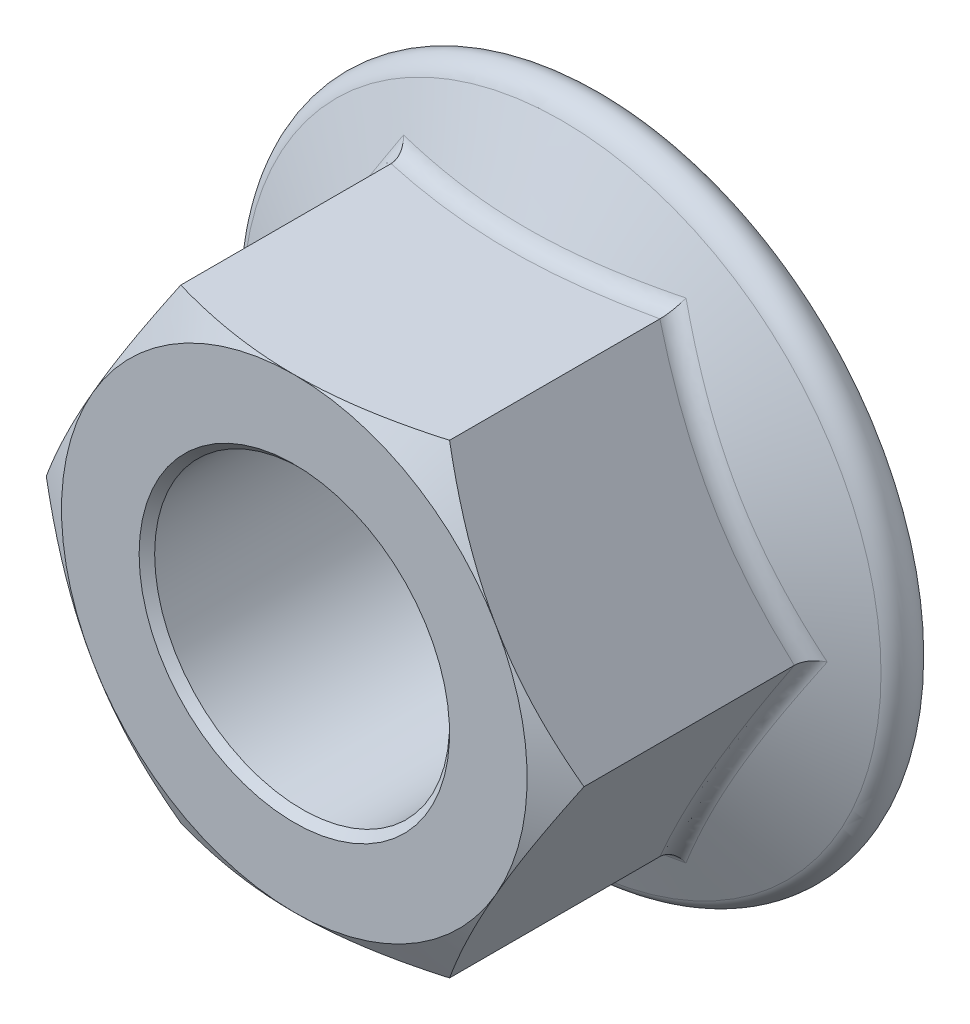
SolidWorks part; units mm, degrees
ref_plane "Front" through (0, 0, 0) normal (0, 0, 1) x (1, 0, 0)
ref_plane "Top" through (0, 0, 0) normal (0, 1, 0) x (1, 0, 0)
ref_plane "Right" through (0, 0, 0) normal (1, 0, 0) x (0, 0, -1)
other "Configuration Table"
sketch "Sketch1" plane through (0, 0, 0) normal (0, 0, 1) x (1, 0, 0)
  line L1 (8.6603, -15) -> (17.3205, 0)
  line L2 (17.3205, 0) -> (8.6603, 15)
  line L3 (8.6603, 15) -> (-8.6603, 15)
  line L4 (-8.6603, 15) -> (-17.3205, 0)
  line L5 (-17.3205, 0) -> (-8.6603, -15)
  line L6 (-8.6603, -15) -> (8.6603, -15)
  circle A0 centre (0, 0) radius 15 construction
  circle A1 centre (0, 0) radius 9.5
extrude "BaseNut" add sketch "Sketch1" against normal blind 20
sketch "Sketch3" plane through (0.6779, 0, -16.6426) normal (0, 1, 0) x (0, 0, -1)
  line L0 (4.0352, 0.6779) -> (-19.0613, 0.6779) construction
  line L2 (-16.6426, 15.6779) -> (-15.3029, 17.9984)
  line L4 (-15.3029, 17.9984) -> (-16.6426, 17.9984)
  line L5 (-16.6426, 17.9984) -> (-16.6426, 15.6779)
  line L6 (-6.6426, 17.9984) -> (-6.6426, 14.238) construction
  line L8 (3.3574, 17.9984) -> (3.3574, 15.6779)
  line L9 (2.0176, 17.9984) -> (3.3574, 17.9984)
  line L10 (3.3574, 15.6779) -> (2.0176, 17.9984)
  line L11 (3.3574, 17.9984) -> (-16.6426, 17.9984) construction
revolve "Double-Chamfer" cut sketch "Sketch3" angle 360 about L0
sketch "Sketch4" plane through (4.6827, 0, -16.7173) normal (0, 1, 0) x (0, 0, -1)
  line L0 (-21.7744, 4.6827) -> (9.7398, 4.6827) construction
  line L2 (-4.6401, 30.5008) -> (-4.6401, 8.9315) construction
  line L3 (0.5185, 25.2455) -> (-4.6401, 14.1827)
  line L4 (3.2827, 14.1827) -> (-16.7173, 14.1827) construction
  line L5 (3.2827, 14.1827) -> (3.2827, 24.6327)
  line L11 (-4.6401, 14.1827) -> (3.2827, 14.1827)
  arc A0 (3.2827, 24.6327) -> (0.5185, 25.2455) centre (1.8327, 24.6327) ccw
revolve "Flange" add sketch "Sketch4" angle 360 about L0
fillet "FlangeFillet" radius 1.2 6 edges at (-10.9757, -10.9896, -14.8899) (-15.0051, 4.0104, -14.8899) (10.9757, 10.9896, -14.8899) (15.0051, -4.0104, -14.8899)
sketch "Sketch5" plane through (-5.1971, 0, -15.1971) normal (0, 1, 0) x (0, 0, -1)
  line L0 (3.5984, -5.1971) -> (-23.9926, -5.1971) construction
  line L1 (4.8029, 4.3029) -> (-15.1971, 4.3029) construction
  line L2 (-15.1971, 4.8029) -> (-15.1971, 4.3029)
  line L4 (-15.1971, 4.3029) -> (-14.6971, 4.3029)
  line L6 (-14.6971, 4.3029) -> (-15.1971, 4.8029)
  line L7 (-5.1971, 4.3029) -> (-5.1971, 0.9419) construction
  line L8 (4.3029, 4.3029) -> (4.8029, 4.8029)
  line L9 (4.8029, 4.3029) -> (4.3029, 4.3029)
  line L10 (4.8029, 4.8029) -> (4.8029, 4.3029)
  dimension "da" = 20
  dimension "D2" = 45
revolve "Hole" cut sketch "Sketch5" angle 360 about L0
sketch "Sketch6" plane through (0, 0, 0) normal (0, 1, 0) x (1, 0, 0)
  line L0 (-9.933, 0.5) -> (-9.5, 0.25)
  line L1 (-9.5, 0.25) -> (-9, 0.25)
  line L2 (-9, 0.25) -> (-9, 0.75)
  line L3 (-9, 0.75) -> (-9.5, 0.75)
  line L4 (-9.5, 0.75) -> (-9.933, 0.5)
  line L5 (0, 7.348) -> (0, 34.1252) construction
revolve "Cut-Revolve10" [suppressed] cut sketch "Sketch6" angle 360 about L5
pattern_linear "LPattern10" [suppressed] count 33 spacing 0.6 along (0, 0, -1)
equation "\"m1@Sketch4\" = \"m@BaseNut\""
equation "\"sq@Sketch3\" = \"s@Sketch1\""
equation "\"D2@Sketch6\"=\"D1@Sketch1\""
equation "\"D1@Sketch6\"= (\"D2@ThreadCosmetic1\"  - \"D2@Sketch6\" )  / 2"
equation "\"D3@LPattern10\"=\"D1@Sketch6\" * 1.2 "
equation "\"D1@LPattern10\"=\"m@BaseNut\"  / \"D3@LPattern10\""
